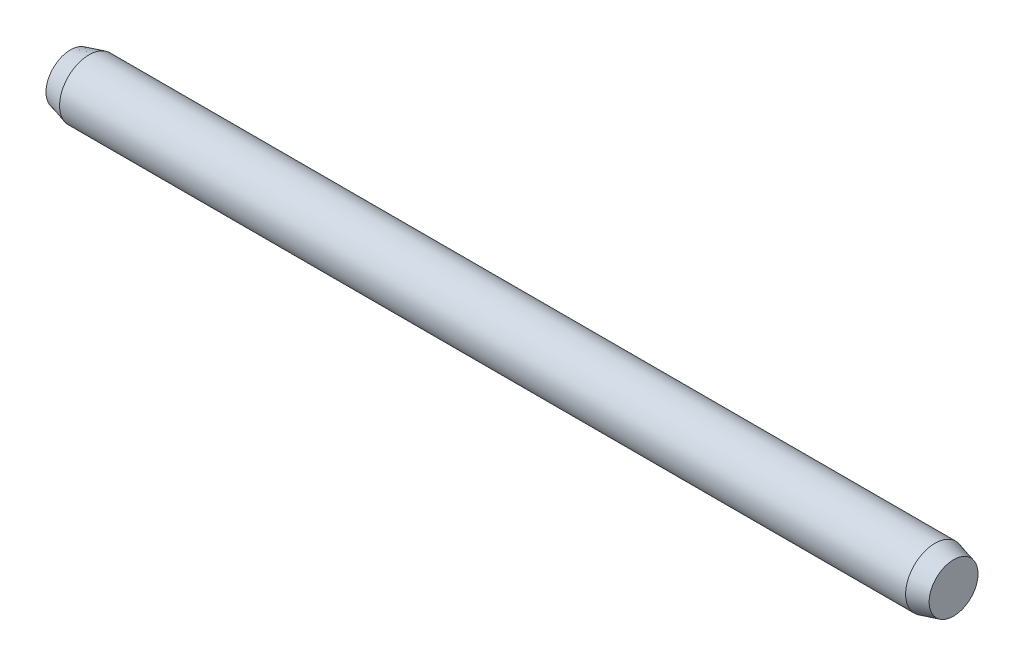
SolidWorks part; units mm, degrees
ref_plane "Plane1" through (0, 0, 0) normal (0, 0, 1) x (1, 0, 0)
ref_plane "Plane2" through (0, 0, 0) normal (0, 1, 0) x (1, 0, 0)
ref_plane "Plane3" through (0, 0, 0) normal (1, 0, 0) x (0, 0, -1)
revolve "Base-Revolve" add sketch "Sketch1" angle 360 about L1
sketch "Sketch1" plane through (0, 0, 0) normal (0, 0, 1) x (1, 0, 0)
  line L1 (-6.35, 0) -> (107.95, 0) construction
  line L2 (0, 0) -> (30, 0)
  line L3 (30, 0) -> (30, 0.8312)
  line L4 (30, 0.8312) -> (29.37, 1)
  line L5 (29.37, 1) -> (0.63, 1)
  line L6 (0, 0.8312) -> (0, 0)
  line L7 (0, 0.8312) -> (0.63, 1)
  dimension "D1" = 0.63
  dimension "D2" = 15
  dimension "D3" = 15
  dimension "Diameter" = 2
  dimension "Length" = 30
  dimension "Chamfer_len" = 0.63
equation "\"D3@Sketch1\" = 15.0"
equation "\"D1@Sketch1\" = \"Chamfer_len@Sketch1\""
equation "\"D2@Sketch1\" = \"D3@Sketch1\""
